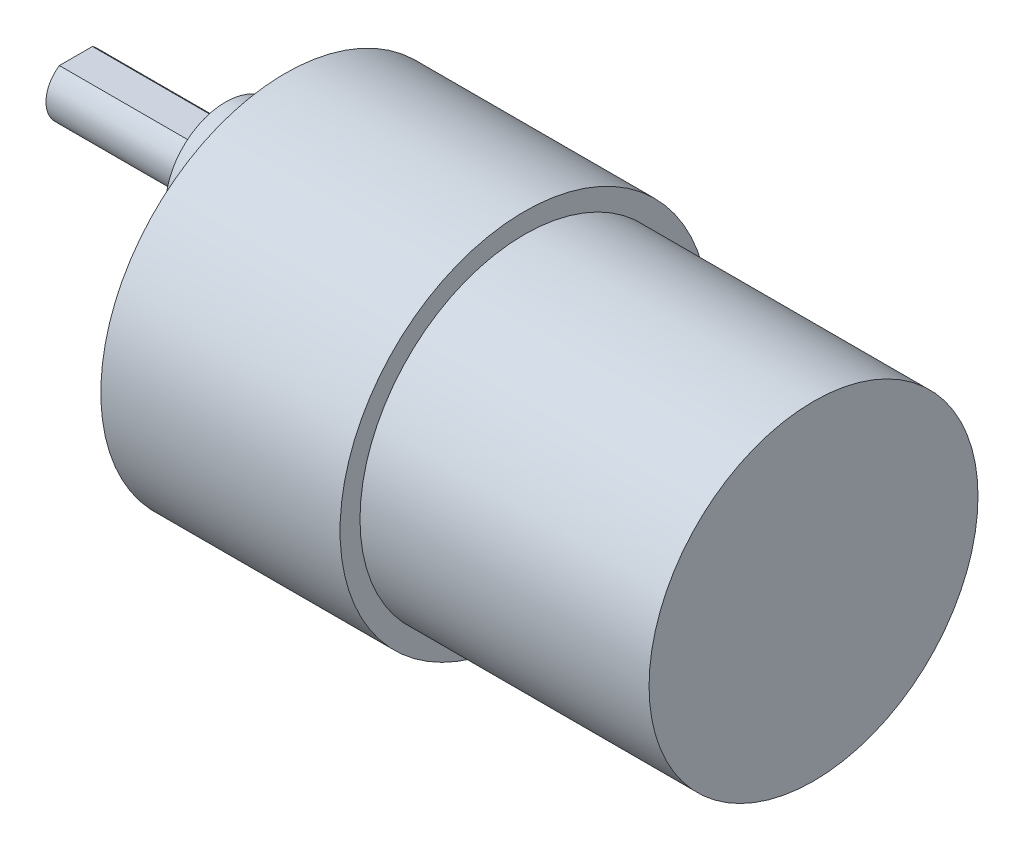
SolidWorks part; units mm, degrees
ref_plane "Front Plane" through (0, 0, 0) normal (0, 0, 1) x (1, 0, 0)
ref_plane "Top Plane" through (0, 0, 0) normal (0, 1, 0) x (1, 0, 0)
ref_plane "Right Plane" through (0, 0, 0) normal (1, 0, 0) x (0, 0, -1)
sketch "Sketch1" plane through (0, 0, 0) normal (1, 0, 0) x (0, 0, -1)
  line L0 (-18.5, 0) -> (18.5, 0) construction
  line L1 (0, -18.5) -> (0, 18.5) construction
  circle A0 centre (0, 0) radius 18.5
  dimension "D1" = 37
extrude "main head" add sketch "Sketch1" along normal blind 24
sketch "Sketch2" plane through (0, 0, 0) normal (-1, 0, 0) x (0, 0, 1)
  line L0 (0, -18.5) -> (0, 18.5) construction
  circle A0 centre (0, 7) radius 6
  dimension "D1" = 12
  dimension "D2" = 7
extrude "Boss-Extrude2" add sketch "Sketch2" along normal blind 6
sketch "Sketch3" plane through (-6, 0, 0) normal (-1, 0, 0) x (0, 0, 1)
  line L0 (0, -18.5) -> (0, 18.5) construction
  line L1 (-1.6583, 9.5) -> (1.6583, 9.5)
  arc A0 (-1.6583, 9.5) -> (1.6583, 9.5) centre (0, 7) ccw
  point P4 (-1.6583, 9.5)
  point P6 (1.6583, 9.5)
  point P9 (0, 4)
  dimension "D2" = 6
  dimension "D1" = 7
  dimension "D3" = 5.5
extrude "motorshaft" add sketch "Sketch3" along normal blind 15
sketch "Sketch4" plane through (24, 0, 0) normal (1, 0, 0) x (0, 0, -1)
  circle A0 centre (0, 0) radius 16.5
  dimension "D1" = 33
extrude "back part" add sketch "Sketch4" along normal blind 29
sketch "Sketch5" plane through (0, 0, 0) normal (-1, 0, 0) x (0, 0, 1)
  circle A0 centre (0, 0) radius 15.5 construction
  circle A1 centre (-15.5, 0) radius 1.3727
  circle A2 centre (-7.75, 13.4234) radius 1.3727
  circle A3 centre (7.75, 13.4234) radius 1.3727
  circle A4 centre (15.5, 0) radius 1.3727
  circle A5 centre (7.75, -13.4234) radius 1.3727
  circle A6 centre (-7.75, -13.4234) radius 1.3727
  point P17 (0, 0)
  dimension "D1" = 31
  dimension "D2" = 2.7454
  dimension "D3" = 6
hole_wizard "Ø3.0mm Dowel Hole1" positions "Sketch9" profile "Sketch8" hole size "Ø3.0" standard "ANSI Metric"
sketch "Sketch9" plane through (0, 0, 0) normal (-1, 0, 0) x (0, 0, 1)
  point P0 (-15.5, 0)
  point P3 (-7.75, 13.4234)
  point P6 (7.75, 13.4234)
  point P9 (15.5, 0)
  point P12 (7.75, -13.4234)
  point P15 (-7.75, -13.4234)
sketch "Sketch8" plane through (0, 0, -15.5) normal (0, 1, 0) x (0, 0, 1)
  line L0 (0, 0) -> (0, 9.9513)
  line L1 (0, 9.9513) -> (1.5, 9.05)
  line L2 (1.5, 9.05) -> (1.5, 0)
  line L5 (1.5, 0) -> (0, 0)
  line L10 (0, 9.9513) -> (-1.5, 9.05) construction
  line L11 (0, -6.35) -> (0, 107.95) construction
  dimension "Hole Dia." = 3
  dimension "Hole Depth" = 9.05
  dimension "Drill Angle" = 118
